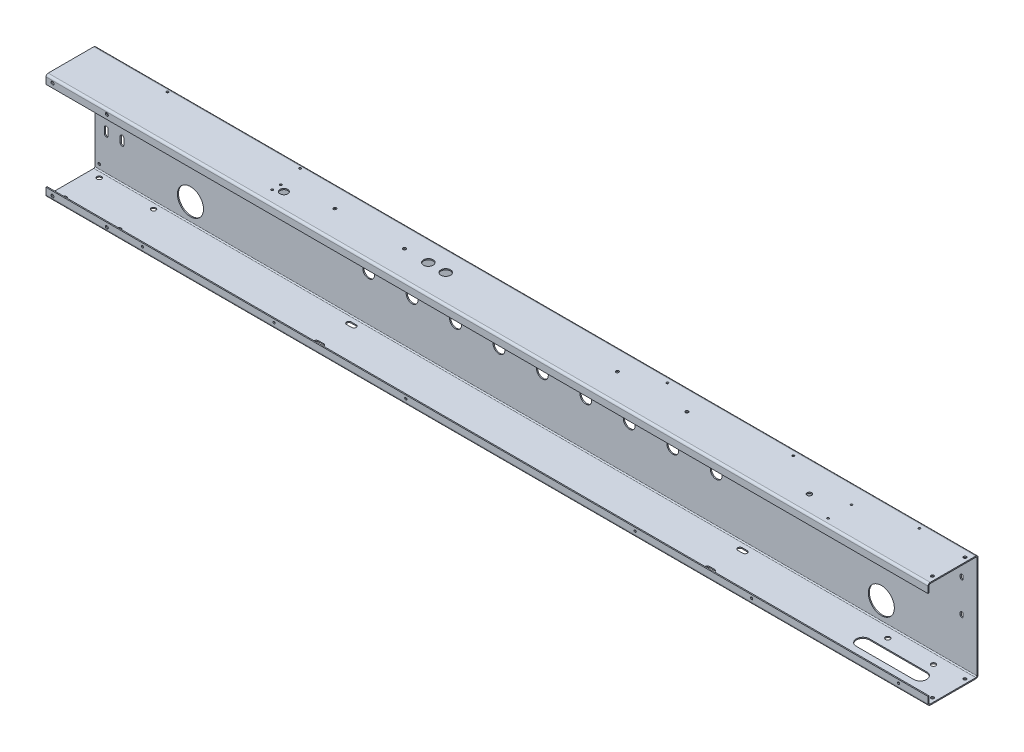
SolidWorks part; units mm, degrees
ref_plane "Plan de face" through (0, 0, 0) normal (0, 0, 1) x (1, 0, 0)
ref_plane "Plan de dessus" through (0, 0, 0) normal (0, 1, 0) x (1, 0, 0)
ref_plane "Plan de droite" through (0, 0, 0) normal (1, 0, 0) x (0, 0, -1)
mirrored part "CU010971-P_Rendre symétrique"
other "<CU010971-P>-<Ø6.1>"
